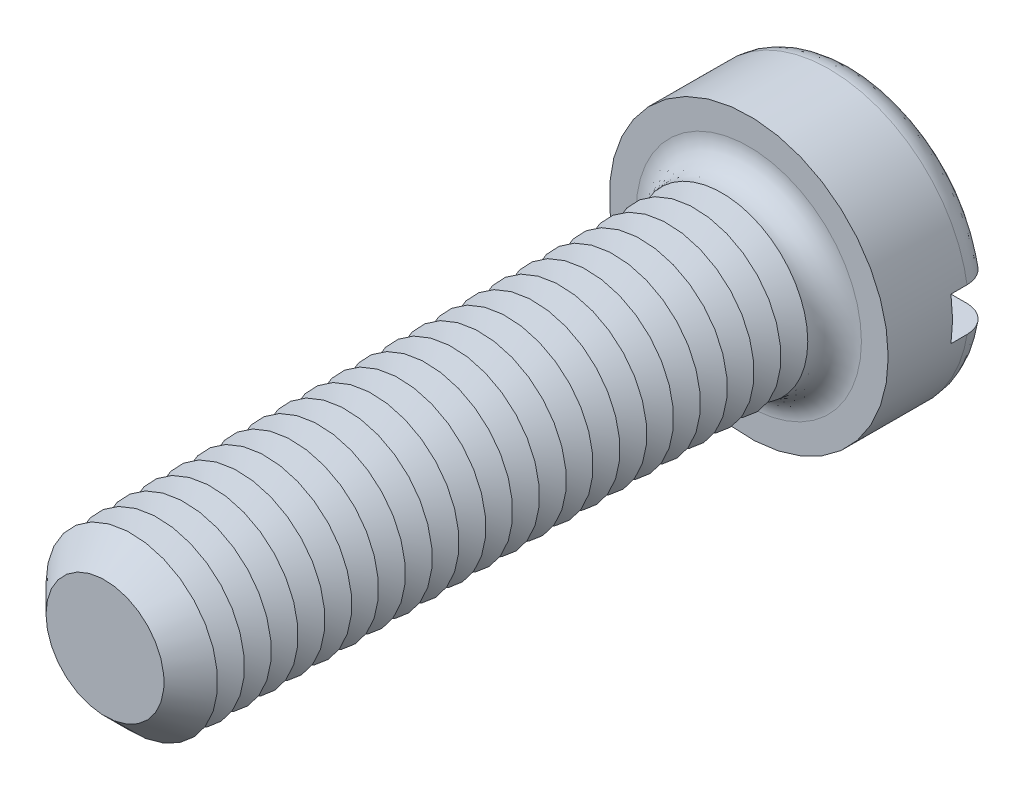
SolidWorks part; units mm, degrees
ref_plane "Front Plane" through (0, 0, 0) normal (0, 0, 1) x (1, 0, 0)
ref_plane "Top Plane" through (0, 0, 0) normal (0, 1, 0) x (1, 0, 0)
ref_plane "Right Plane" through (0, 0, 0) normal (1, 0, 0) x (0, 0, -1)
sketch "Sketch3" plane through (0, 0, 0) normal (0, 0, 1) x (1, 0, 0)
  circle A0 centre (0, 0) radius 6.5
  dimension "D1" = 13
extrude "Boss-Extrude2" add sketch "Sketch3" against normal blind 5
sketch "Sketch4" plane through (0, 0, 0) normal (0, 0, 1) x (1, 0, 0)
  circle A0 centre (0, 0) radius 4
  dimension "D1" = 8
extrude "Boss-Extrude3" add sketch "Sketch4" along normal blind 30
fillet "Fillet1" radius 1.25 2 edges at (6.5, 0, -5) (4, 0, 0)
chamfer "Chamfer1" distance 1.25 angle 45 1 edges at (4, 0, 30)
sketch "Sketch5" plane through (0, 0, 0) normal (1, 0, 0) x (0, 0, -1)
  line L0 (1.6944, 0) -> (-7.6738, 0) construction
sketch "Sketch6" plane through (0, 0, 0) normal (1, 0, 0) x (0, 0, -1)
  line L0 (-1.25, 4) -> (-1.875, 2.9175)
  line L1 (-1.875, 2.9175) -> (-2.5, 4)
  line L2 (-1.25, 4) -> (-28.75, 4) construction
  line L3 (-2.5, 4) -> (-1.25, 4)
  dimension "D1" = 1.25
revolve "Cut-Revolve1" cut sketch "Sketch6" angle 360 about L0
pattern_linear "LPattern1" count 22 spacing 1.25 along (0, 0, 1) of "Cut-Revolve1"
sketch "Sketch8" plane through (0, 0, -5) normal (0, 0, -1) x (-1, 0, 0)
  line L1 (6.5, -1) -> (-6.5, -1)
  line L2 (6.5, -1) -> (6.5, 1)
  line L3 (6.5, 1) -> (-6.5, 1)
  line L4 (-6.5, -1) -> (-6.5, 1)
  line L5 (6.5, -1) -> (-6.5, 1) construction
  line L6 (6.5, 1) -> (-6.5, -1) construction
  point P0 (0, 0)
  dimension "D1" = 13
  dimension "D2" = 2
extrude "Cut-Extrude1" cut sketch "Sketch8" against normal blind 2
